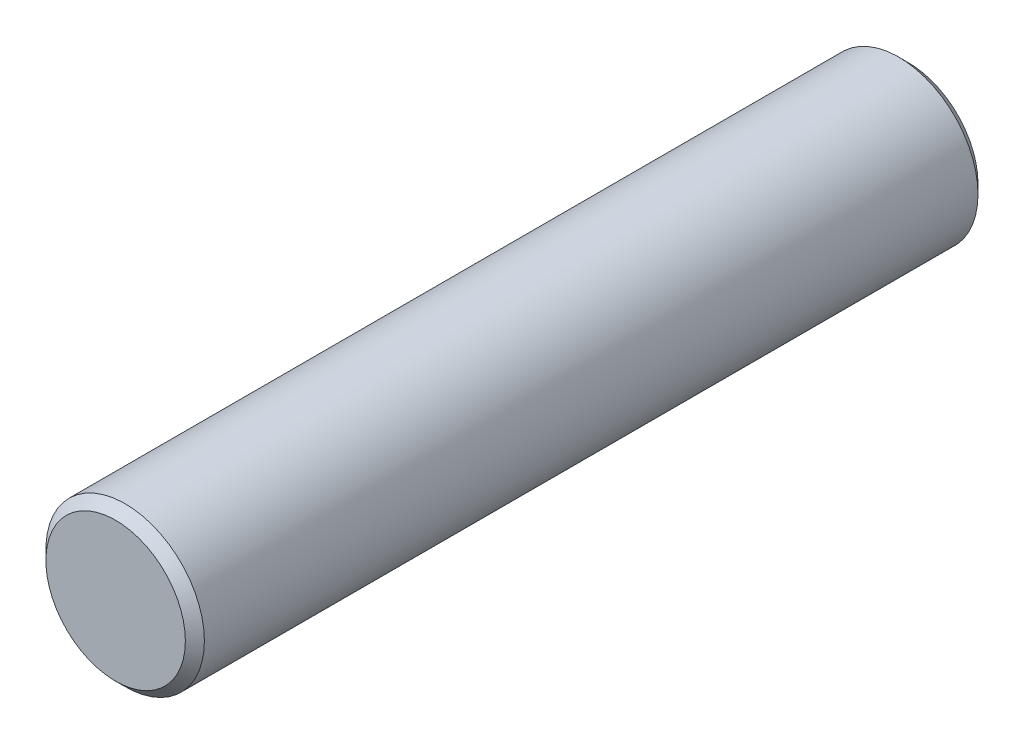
SolidWorks part; units mm, degrees
ref_plane "Plan de face" through (0, 0, 0) normal (0, 0, 1) x (1, 0, 0)
ref_plane "Plan de dessus" through (0, 0, 0) normal (0, 1, 0) x (1, 0, 0)
ref_plane "Plan de droite" through (0, 0, 0) normal (1, 0, 0) x (0, 0, -1)
sketch "Esquisse1" plane through (0, 0, 0) normal (0, 0, 1) x (1, 0, 0)
  circle A0 centre (-31.0331, 51.6837) radius 2.5
  dimension "D1" = 5
extrude "Extrusion1" add sketch "Esquisse1" against normal up to surface (25 mm away)
chamfer "Chanfrein1" distance 0.3 angle 45 2 edges at (-28.5331, 51.6837, 0) (-31.0331, 49.1837, -25)
